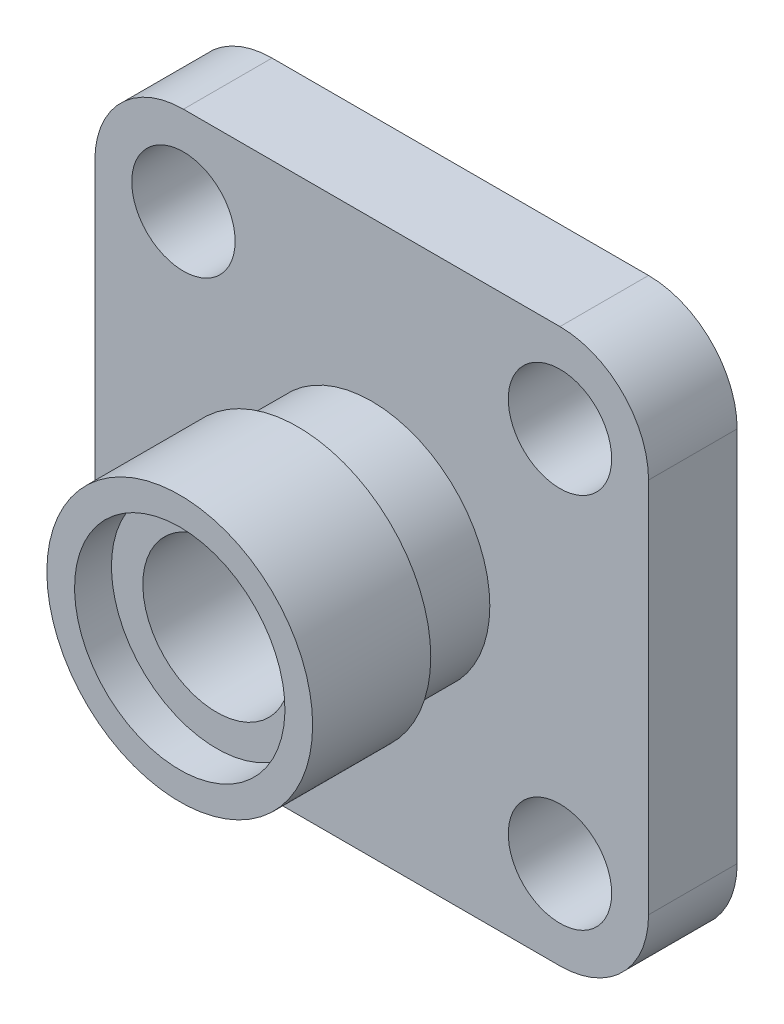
SolidWorks part; units mm, degrees
ref_plane "前视基准面" through (0, 0, 0) normal (0, 0, 1) x (1, 0, 0)
ref_plane "上视基准面" through (0, 0, 0) normal (0, 1, 0) x (1, 0, 0)
ref_plane "右视基准面" through (0, 0, 0) normal (1, 0, 0) x (0, 0, -1)
other "Configuration Table"
sketch "草图1" plane through (0, 0, 0) normal (0, 0, 1) x (1, 0, 0)
  line L1 (25.5, -37.5) -> (-25.5, -37.5)
  line L2 (37.5, -25.5) -> (37.5, 25.5)
  line L3 (25.5, 37.5) -> (-25.5, 37.5)
  line L4 (-37.5, -25.5) -> (-37.5, 25.5)
  line L5 (37.5, -37.5) -> (-37.5, 37.5) construction
  line L6 (37.5, 37.5) -> (-37.5, -37.5) construction
  arc A0 (25.5, 37.5) -> (37.5, 25.5) centre (25.5, 25.5) cw
  arc A1 (37.5, -25.5) -> (25.5, -37.5) centre (25.5, -25.5) cw
  arc A2 (-25.5, -37.5) -> (-37.5, -25.5) centre (-25.5, -25.5) cw
  arc A3 (-37.5, 25.5) -> (-25.5, 37.5) centre (-25.5, 25.5) cw
  circle A4 centre (-25.5, 25.5) radius 7
  circle A5 centre (25.5, 25.5) radius 7
  circle A6 centre (25.5, -25.5) radius 7
  circle A7 centre (-25.5, -25.5) radius 7
  point P0 (0, 0)
  dimension "D3" = 12
  dimension "D4" = 14
  dimension "D1" = 75
  dimension "D2" = 75
extrude "凸台-拉伸1" add sketch "草图1" along normal blind 12
sketch "草图2" plane through (0, 0, 0) normal (1, 0, 0) x (0, 0, -1)
  line L0 (-48.4219, 0) -> (49.5945, 0) construction
  line L1 (0, 26.5) -> (1, 26.5)
  line L2 (0, -25.5) -> (0, 25.5) construction
  line L3 (1, 26.5) -> (1, 25)
  line L4 (1, 25) -> (6, 25)
  line L5 (6, 25) -> (6, 20.5)
  line L6 (6, 20.5) -> (10, 20.5)
  line L7 (10, 20.5) -> (10, 0)
  line L8 (-12, 16) -> (-38, 16)
  line L9 (-12, -25.5) -> (-12, 25.5) construction
  line L10 (-38, 16) -> (-38, 0)
  line L11 (0, 26.5) -> (-12, 16)
  line L12 (10, 0) -> (-38, 0)
  point P17 (6, 22.75)
  dimension "D1" = 44
  dimension "D2" = 1
  dimension "D3" = 6
  dimension "D4" = 4
  dimension "D5" = 41
  dimension "D6" = 50
  dimension "D7" = 53
  dimension "D8" = 32
revolve "旋转1" add sketch "草图2" angle 360 about L0
sketch "草图3" plane through (0, 0, 0) normal (1, 0, 0) x (0, 0, -1)
  line L0 (10, 0) -> (-38, 0) construction
  line L2 (-38, 14.25) -> (-33, 14.25)
  line L3 (-38, 16) -> (-38, -16) construction
  line L4 (-33, 14.25) -> (-33, 10)
  line L5 (-33, 10) -> (3, 10)
  line L6 (3, 10) -> (3, 17.5)
  line L7 (3, 17.5) -> (10, 17.5)
  line L8 (10, -20.5) -> (10, 20.5) construction
  line L9 (-38, 14.25) -> (-38, 0)
  line L10 (10, 17.5) -> (10, 0)
  line L11 (-38, 0) -> (10, 0)
  point P0 (-37.3084, 0)
  point P2 (0, 0)
  point P3 (9.1575, 0)
  point P10 (0, 0)
  dimension "D1" = 7
  dimension "D2" = 35
  dimension "D3" = 20
  dimension "D4" = 28.5
  dimension "D5" = 5
revolve "切除-旋转1" cut sketch "草图3" angle 360 about L0
sketch "草图8" plane through (0, 0, 38) normal (0, 0, 1) x (1, 0, 0)
  circle A0 centre (0, 0) radius 18
  circle A1 centre (0, 0) radius 16 construction
  circle A2 centre (0, 0) radius 16
  dimension "D1" = 36
extrude "凸台-拉伸2" add sketch "草图8" against normal blind 16
